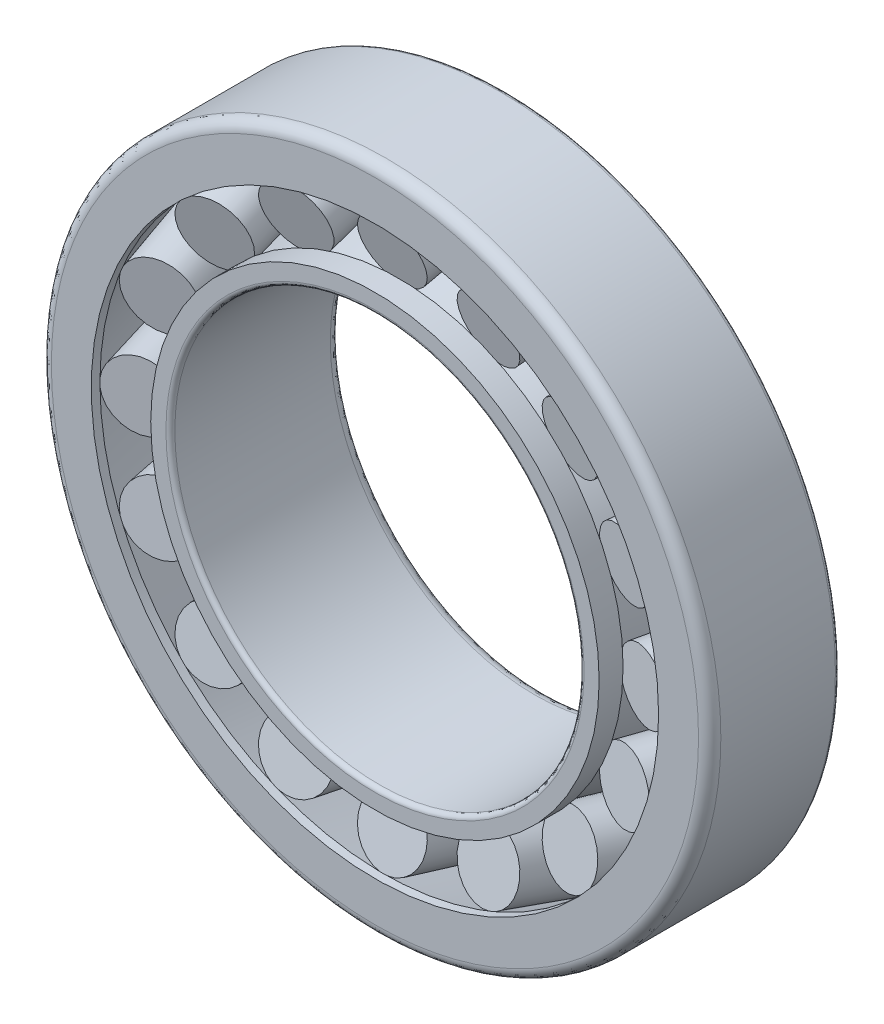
SolidWorks part; units mm, degrees
ref_plane "Front Plane" through (0, 0, 0) normal (0, 0, 1) x (1, 0, 0)
ref_plane "Top Plane" through (0, 0, 0) normal (0, 1, 0) x (1, 0, 0)
ref_plane "Right Plane" through (0, 0, 0) normal (1, 0, 0) x (0, 0, -1)
sketch "BaseSke" plane through (0, 0, 0) normal (1, 0, 0) x (0, 0, -1)
  line L0 (-47.2296, 0) -> (24.6132, 0) construction
  line L2 (0, 129.5214) -> (0, -86.3012) construction
  line L3 (8.6572, 41.7141) -> (-31.6572, 30.7859) construction
  line L4 (-23, 45) -> (-5.5, 45) construction
  line L5 (-23, 27.5) -> (0, 27.5) construction
  line L6 (-11.5, 36.25) -> (-18.5822, 62.3763) construction
  line L7 (-21.85, 38.1543) -> (-6.65, 42.705)
  line L8 (-6.65, 42.705) -> (-5.352, 37.9166)
  line L9 (-5.352, 37.9166) -> (-20.6606, 33.7668)
  line L10 (-20.6606, 33.7668) -> (-21.85, 38.1543)
  line L11 (-23, 45) -> (-23, 38.135) construction
  line L12 (-21.8448, 38.135) -> (-5.5, 43.0284) construction
  line L13 (-5.5, 45) -> (-5.5, 43.0284) construction
  line L14 (-21.8448, 38.135) -> (-23, 38.135) construction
  line L15 (-19.4713, 29.3792) -> (-4.054, 33.1282) construction
  line L16 (-23, 27.5) -> (-23, 30.1459) construction
  line L17 (-23, 30.1459) -> (-19.7827, 30.1459) construction
  line L18 (0, 33.8948) -> (0, 27.5) construction
  line L19 (-19.7827, 30.1459) -> (-19.5816, 29.4039) construction
  line L20 (-19.5816, 29.4039) -> (-3.9698, 33.2001) construction
  line L21 (-3.9698, 33.2001) -> (-4.1582, 33.8948) construction
  line L22 (-4.1582, 33.8948) -> (0, 33.8948) construction
revolve "Roller" add sketch "BaseSke" angle 360 about L3
sketch "OuterRaceSke" plane through (0, 0, 0) normal (1, 0, 0) x (0, 0, -1)
  line L0 (-21.8448, 38.135) -> (-23, 38.135) construction
  line L1 (-21.8448, 38.135) -> (-5.5, 43.0284) construction
  line L2 (-5.5, 45) -> (-5.5, 43.0284) construction
  line L3 (-23, 45) -> (-5.5, 45) construction
  line L4 (-23, 45) -> (-23, 38.135) construction
  line L5 (-21.8448, 38.135) -> (-23, 38.135)
  line L6 (-21.8448, 38.135) -> (-5.5, 43.0284)
  line L7 (-5.5, 45) -> (-5.5, 43.0284)
  line L8 (-23, 45) -> (-5.5, 45)
  line L9 (-23, 45) -> (-23, 38.135)
  line L10 (-60.3939, 0) -> (35.9926, 0) construction
revolve "OuterRace" add sketch "OuterRaceSke" angle 360 about L10
sketch "InnerRaceSke" plane through (0, 0, 0) normal (1, 0, 0) x (0, 0, -1)
  line L0 (-23, 27.5) -> (0, 27.5) construction
  line L1 (-23, 27.5) -> (-23, 30.1459) construction
  line L2 (-23, 30.1459) -> (-19.7827, 30.1459) construction
  line L3 (-19.7827, 30.1459) -> (-19.5816, 29.4039) construction
  line L4 (-19.5816, 29.4039) -> (-3.9698, 33.2001) construction
  line L5 (-3.9698, 33.2001) -> (-4.1582, 33.8948) construction
  line L6 (-4.1582, 33.8948) -> (0, 33.8948) construction
  line L7 (0, 33.8948) -> (0, 27.5) construction
  line L8 (-23, 27.5) -> (0, 27.5)
  line L9 (-23, 27.5) -> (-23, 30.1459)
  line L10 (-23, 30.1459) -> (-19.7827, 30.1459)
  line L11 (-19.7827, 30.1459) -> (-19.5816, 29.4039)
  line L12 (-19.5816, 29.4039) -> (-3.9698, 33.2001)
  line L13 (-3.9698, 33.2001) -> (-4.1582, 33.8948)
  line L14 (-4.1582, 33.8948) -> (0, 33.8948)
  line L15 (0, 33.8948) -> (0, 27.5)
  line L16 (-58.1022, 0) -> (39.538, 0) construction
revolve "InnerRace" add sketch "InnerRaceSke" angle 360 about L16
fillet "Fillet1" radius 0.6 2 edges at (45, 0, 5.5) (27.5, 0, 23)
fillet "InnerFillet" radius 1.5 1 edges at (27.5, 0, 0)
fillet "OuterFillet" radius 1.5 1 edges at (45, 0, 23)
pattern_circular "CirPatternBall" count 16 over 360 about axis through (0, 0, 0) along (0, 0, 1) of "Roller"
sketch "Sketch4" plane through (0, 0, 0) normal (1, 0, 0) x (0, 0, -1)
  line L0 (-21.85, 38.1543) -> (-6.65, 42.705)
  line L1 (-6.65, 42.705) -> (-4.054, 33.1282)
  line L2 (-4.054, 33.1282) -> (-19.4713, 29.3792)
  line L3 (-19.4713, 29.3792) -> (-21.85, 38.1543)
  line L4 (-40.3293, 0) -> (19.5574, 0) construction
revolve "Simplified" [suppressed] add sketch "Sketch4" angle 360 about L4
equation "\"D2@BaseSke\" = \"Bearing_Thickness@BaseSke\"/2"
equation "\"D3@BaseSke\" =  ( \"Bearing_Outside_Diameter@BaseSke\" + \"Bearing_Inside_Diameter@BaseSke\" )  / 2"
equation "\"Roller_diameter@BaseSke\" = \"D3@BaseSke\"*1.052"
equation "\"D4@BaseSke\" = \"Bearing_Thickness@BaseSke\"/20"
equation "\"D5@BaseSke\" = \"Bearing_Thickness@BaseSke\" / 20"
equation "\"D8@BaseSke\" = \"Bearing_Thickness@BaseSke\"/30"
equation "\"D11@BaseSke\" = \"D8@BaseSke\""
equation "\"D1@CirPatternBall\" = int(  \"D3@BaseSke\" *  pi  /  ( \"Bearing_Outside_Diameter@BaseSke\" - \"Bearing_Inside_Diameter@BaseSke\" )  * 2.5 ) "
